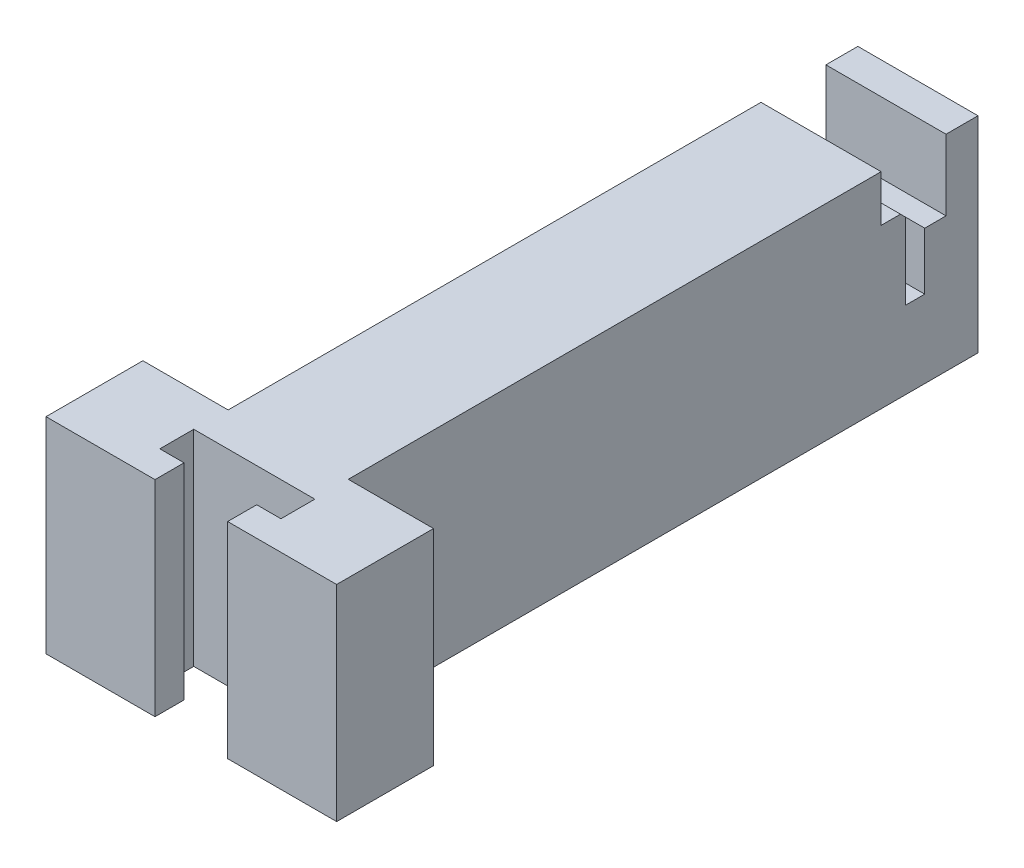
SolidWorks part; units mm, degrees
ref_plane "前视基准面" through (0, 0, 0) normal (0, 0, 1) x (1, 0, 0)
ref_plane "上视基准面" through (0, 0, 0) normal (0, 1, 0) x (1, 0, 0)
ref_plane "右视基准面" through (0, 0, 0) normal (1, 0, 0) x (0, 0, -1)
sketch "草图1" plane through (0, 0, 0) normal (0, 0, 1) x (1, 0, 0)
  line L0 (0, 0) -> (30, 0)
  line L1 (0, 21.2) -> (30, 21.2)
  line L2 (0, 0) -> (0, 21.2)
  line L3 (30, 0) -> (30, 21.2)
extrude "凸台-拉伸1" add sketch "草图1" along normal blind 75
sketch "草图2" plane through (30, 0, 0) normal (1, 0, 0) x (0, 0, -1)
  line L0 (-8, 16.4) -> (-7.5, 15.9)
  line L1 (-5.5, 13.9) -> (-3.3, 13.9)
  line L2 (-3.3, 21.2) -> (0, 21.2)
  line L3 (-10, 16.4) -> (-8, 16.4)
  line L4 (0, 0) -> (0, 21.2)
  line L5 (-75, 0) -> (0, 0)
  line L6 (-10, 16.4) -> (-10, 21.2)
  line L7 (-3.3, 13.9) -> (-3.3, 21.2)
  line L8 (-75, 21.2) -> (-10, 21.2)
  line L9 (-7.5, 8) -> (-5.5, 8)
  line L10 (-7.5, 8) -> (-7.5, 15.9)
  line L11 (-5.5, 8) -> (-5.5, 13.9)
  line L12 (-75, 0) -> (-75, 21.2)
extrude "切除-拉伸1" cut sketch "草图2" against normal blind 75 flip side to cut
sketch "草图4" plane through (0, 21.2, 0) normal (0, 1, 0) x (1, 0, 0)
  line L0 (8.8, -65) -> (8.8, 0)
  line L1 (21.2, -65) -> (21.2, 0)
  line L2 (8.8, 0) -> (21.2, 0)
  line L3 (0, -65) -> (8.8, -65)
  line L4 (0, -75) -> (11.25, -75)
  line L5 (0, -75) -> (0, -65)
  line L6 (30, -75) -> (30, -65)
  line L7 (21.2, -65) -> (30, -65)
  line L8 (8.75, -72) -> (11.25, -72)
  line L9 (8.75, -68.5) -> (21.25, -68.5)
  line L10 (11.25, -75) -> (11.25, -72)
  line L11 (8.75, -72) -> (8.75, -68.5)
  line L12 (21.25, -72) -> (21.25, -68.5)
  line L13 (18.75, -72) -> (21.25, -72)
  line L14 (18.75, -75) -> (30, -75)
  line L15 (18.75, -72) -> (18.75, -75)
extrude "切除-拉伸3" cut sketch "草图4" against normal blind 75 flip side to cut
